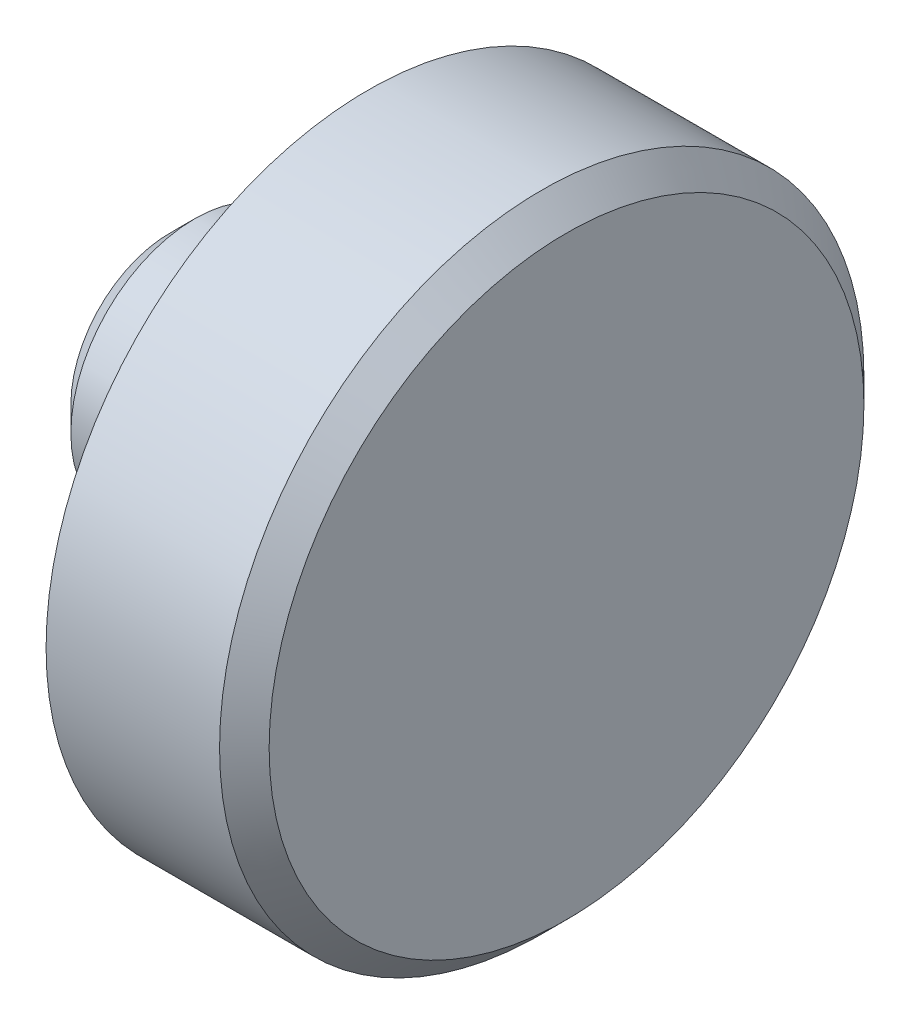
SolidWorks part; units mm, degrees
ref_plane "Plan de face" through (0, 0, 0) normal (0, 0, 1) x (1, 0, 0)
ref_plane "Plan de dessus" through (0, 0, 0) normal (0, 1, 0) x (1, 0, 0)
ref_plane "Plan de droite" through (0, 0, 0) normal (1, 0, 0) x (0, 0, -1)
sketch "Esquisse1" plane through (0, 0, 0) normal (0, 0, 1) x (1, 0, 0)
  line L0 (0, 0) -> (-23.8933, 0) construction
  line L1 (0, 0) -> (0, 6.5)
  line L2 (0, 6.5) -> (-4, 6.5)
  line L3 (-4, 6.5) -> (-4, 2.5)
  line L4 (-4, 2.5) -> (-8, 2.5)
  line L5 (-8, 2.5) -> (-8, 0)
  line L6 (0, 0) -> (-8, 0)
  dimension "D1" = 13
  dimension "D2" = 5
  dimension "D3" = 4
  dimension "D4" = 4
revolve "Révolution1" add sketch "Esquisse1" angle 360 about L0
chamfer "Chanfrein1" distance 0.5 angle 45 2 edges at (0, 0, -6.5) (-8, 0, -2.5)
